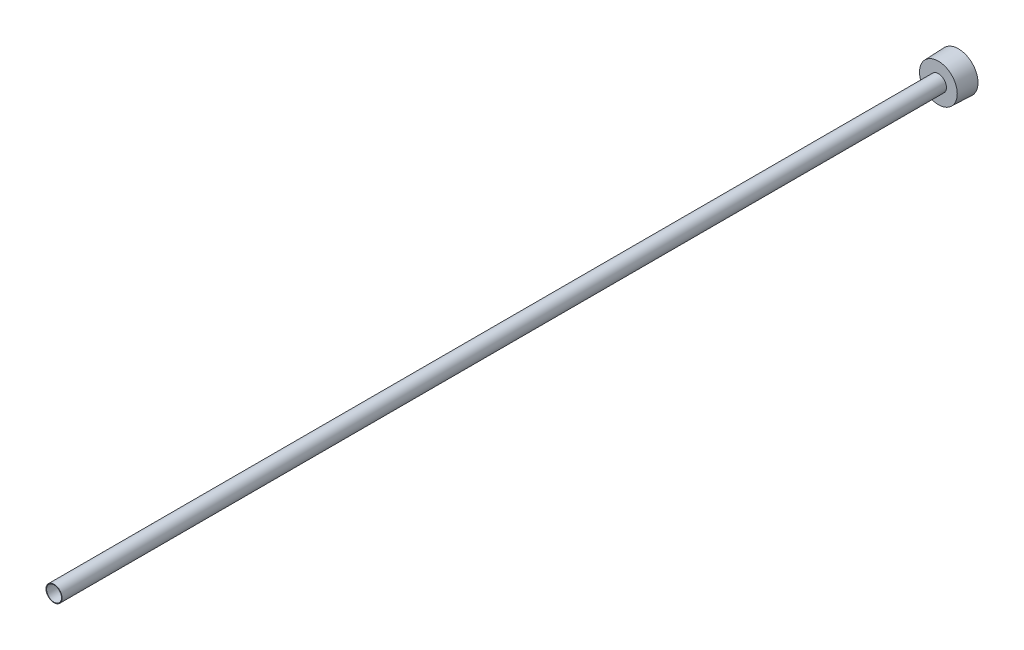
SolidWorks part; units mm, degrees
ref_plane "Front Plane" through (0, 0, 0) normal (0, 0, 1) x (1, 0, 0)
ref_plane "Top Plane" through (0, 0, 0) normal (0, 1, 0) x (1, 0, 0)
ref_plane "Right Plane" through (0, 0, 0) normal (1, 0, 0) x (0, 0, -1)
sketch "Sketch1" plane through (0, 0, 0) normal (1, 0, 0) x (0, 0, -1)
  line L0 (-278.0011, 0) -> (49721.9989, 0) construction
  line L1 (-609.6, 0) -> (0, 0)
  line L6 (0, 0) -> (0, 13.2207)
  line L7 (0, 13.2207) -> (-13.4874, 12.7287)
  line L8 (-13.4874, 12.7287) -> (-13.4874, 5.4229)
  line L9 (-13.4874, 5.4229) -> (-609.6, 5.4229)
  line L10 (-609.6, 5.4229) -> (-609.6, 0)
  dimension "D1" = 13.4874
  dimension "D2" = 26.4414
  dimension "D3" = 2.089
  dimension "D4" = 10.8458
  dimension "D5" = 609.6
revolve "Revolve1" add sketch "Sketch1" angle 360 about L0
sketch "Sketch2" plane through (0, 0, 609.6) normal (0, 0, 1) x (1, 0, 0)
  circle A0 centre (0, 0) radius 5.0419
  dimension "D1" = 10.0838
extrude "Cut-Extrude1" cut sketch "Sketch2" against normal through all
sketch "Sketch3" plane through (0, 0, 0) normal (0, 0, -1) x (-1, 0, 0)
  line L0 (0, 14.5428) -> (0, -14.5428) construction
  line L1 (0, -10.9985) -> (9.525, -5.4993)
  line L2 (9.525, -5.4993) -> (9.525, 5.4993)
  line L3 (9.525, 5.4993) -> (0, 10.9985)
  line L4 (0, 10.9985) -> (-9.525, 5.4993)
  line L5 (-9.525, 5.4993) -> (-9.525, -5.4993)
  line L6 (-9.525, -5.4993) -> (0, -10.9985)
  circle A0 centre (0, 0) radius 9.525 construction
  dimension "D1" = 19.05
extrude "Cut-Extrude2" cut sketch "Sketch3" against normal blind 9.525
